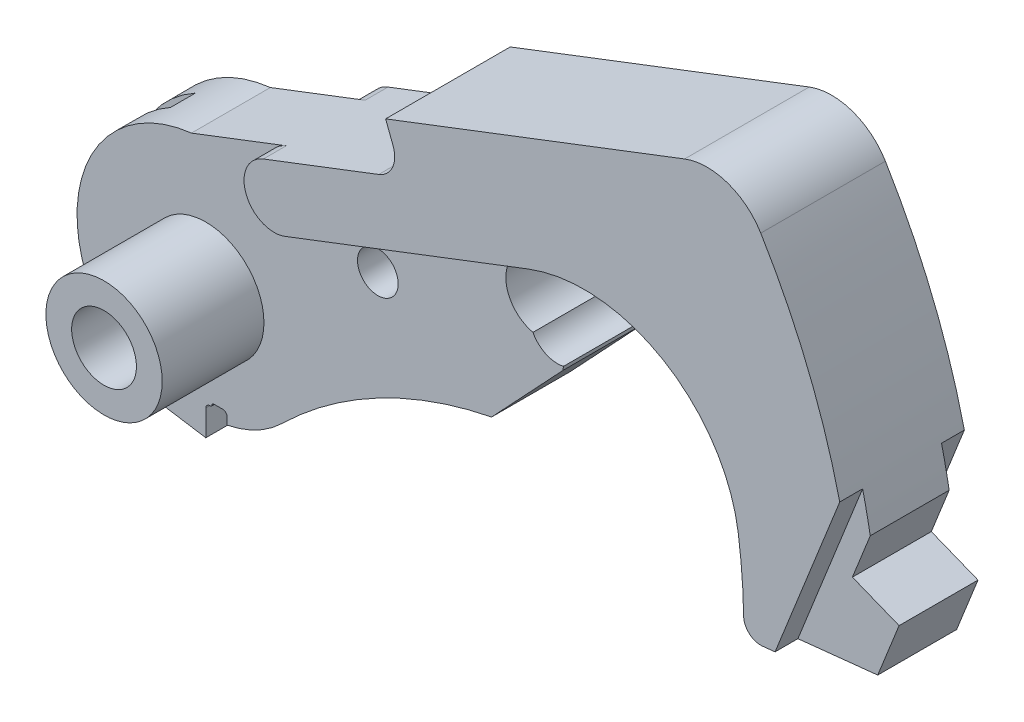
SolidWorks part; units mm, degrees
ref_plane "Front Plane" through (0, 0, 0) normal (0, 0, 1) x (1, 0, 0)
ref_plane "Top Plane" through (0, 0, 0) normal (0, 1, 0) x (1, 0, 0)
ref_plane "Right Plane" through (0, 0, 0) normal (1, 0, 0) x (0, 0, -1)
sketch "Sketch1" plane through (0, 0, 0) normal (0, 0, 1) x (1, 0, 0)
  circle A0 centre (0, 0) radius 1.9812
  circle A1 centre (0, 0) radius 3.556
  dimension "D1" = 3.9624
  dimension "D2" = 7.112
extrude "PinBoss" add sketch "Sketch1" along normal mid plane 17.272
sketch "Sketch2" plane through (0, 0, 0) normal (0, 0, 1) x (1, 0, 0)
  line L0 (0, -6.2994) -> (0, -7.874)
  line L1 (0, -7.874) -> (-2.4332, -7.4886)
  line L2 (0, -7.874) -> (-11.5163, -7.874) construction
  line L3 (0.254, -6.0454) -> (0.2794, -6.0454)
  line L4 (0.381, -5.9438) -> (0.381, -5.9436)
  line L5 (0.4826, -5.842) -> (1.0414, -5.842)
  line L6 (1.2954, -6.096) -> (1.2954, -6.5534)
  line L7 (0, 0) -> (17.4582, -45.4801) construction
  line L8 (0, 0) -> (0, -33.5309) construction
  line L9 (17.4765, 1.9642) -> (21.8252, 6.6015)
  line L10 (21.8252, 6.6015) -> (21.8765, 6.8503)
  line L11 (19.7173, 11.7859) -> (21.113, 12.3216)
  line L12 (15.6717, 16.3716) -> (21.2407, 1.8636) construction
  line L13 (20.0059, 7.7142) -> (17.916, -2.4134) construction
  line L14 (35.436, -0.4896) -> (41.0893, 0.1046)
  line L15 (0, 0) -> (50.1318, 19.2438) construction
  line L16 (41.0893, 0.1046) -> (42.3951, 3.3774)
  line L17 (42.3951, 3.3774) -> (39.5405, 4.5163)
  line L18 (39.5405, 4.5163) -> (40.6326, 7.2538)
  line L19 (12.3928, 15.912) -> (30.677, 22.9307)
  line L20 (11.9713, 12.7575) -> (-0.8787, 7.8248)
  line L21 (12.8479, 14.7264) -> (12.3928, 15.912)
  line L22 (10.5209, 6.1608) -> (11.6703, 6.6019) construction
  arc A0 (-0.8787, 7.8248) -> (-2.4332, -7.4886) centre (0, 0) ccw
  circle A1 centre (0, 0) radius 3.556 construction
  circle A2 centre (0, 0) radius 3.556
  arc A3 (1.2954, -6.5534) -> (4.6673, -4.7793) centre (0, 0) ccw
  arc A4 (17.4765, 1.9642) -> (4.6673, -4.7793) centre (22.4137, -22.9513) ccw
  arc A5 (0.381, -5.9436) -> (0.4826, -5.842) centre (0.4826, -5.9436) cw
  arc A6 (0.2794, -6.0454) -> (0.381, -5.9438) centre (0.2794, -5.9438) ccw
  arc A7 (1.0414, -5.842) -> (1.2954, -6.096) centre (1.0414, -6.096) cw
  arc A8 (0.254, -6.0454) -> (0, -6.2994) centre (0.254, -6.2994) ccw
  arc A9 (20.0059, 7.7142) -> (21.8765, 6.8503) centre (21.4957, 8.4829) ccw
  arc A10 (19.7173, 11.7859) -> (20.0059, 7.7142) centre (20.482, 9.794) ccw
  arc A11 (33.9597, 4.7482) -> (21.113, 12.3216) centre (24.5264, 3.4293) ccw
  arc A12 (34.2859, 0.53) -> (33.9597, 4.7482) centre (0, 0) ccw
  arc A13 (40.6326, 7.2538) -> (35.3349, 21.3323) centre (0, 0) ccw
  arc A14 (35.3349, 21.3323) -> (30.677, 22.9307) centre (32.0515, 19.3501) ccw
  arc A15 (11.9713, 12.7575) -> (12.8479, 14.7264) centre (11.4251, 14.1802) ccw
  arc A16 (35.436, -0.4896) -> (34.2859, 0.53) centre (35.3272, 0.5461) cw
  circle A17 centre (10.5209, 6.1608) radius 1.2446
  point P24 (0.381, -6.0454)
  point P29 (0, -6.0454)
  point P37 (20.0059, 7.7142)
  dimension "D2" = 7.874
  dimension "D3" = 13.3604
  dimension "D4" = 50.8
  dimension "D5" = 32.0802
  dimension "D6" = 21
  dimension "D9" = 11.4046
  dimension "D12" = 5.842
  dimension "D16" = 0.1016
  dimension "D17" = 0.254
  dimension "D18" = 3.3528
  dimension "D21" = 3.937
  dimension "D22" = 4.2672
  dimension "D24" = 19.05
  dimension "D26" = 68.58
  dimension "D28" = 21
  dimension "D29" = 4.191
  dimension "D30" = 82.55
  dimension "D32" = 18.8468
  dimension "D33" = 38.1254
  dimension "D35" = 10.414
  dimension "D36" = 7.62
  dimension "D38" = 3.8354
  dimension "D39" = 1.524
  dimension "D40" = 1.0414
  dimension "D42" = 12.192
  dimension "D43" = 2.4892
  dimension "D1" = 9
  dimension "D7" = 12.7
  dimension "D8" = 43.16
  dimension "D10" = 11.66
  dimension "D11" = 20.0406
  dimension "D13" = 0.508
  dimension "D14" = 0.381
  dimension "D15" = 1.2954
  dimension "D19" = 0.254
  dimension "D20" = 21
  dimension "D23" = 20.4978
  dimension "D25" = 18.034
  dimension "D27" = 15
  dimension "D31" = 21.75
  dimension "D34" = 35.052
  dimension "D37" = 17.272
  dimension "D41" = 1.9812
extrude "SearBoss" add sketch "Sketch2" along normal mid plane 4.826
sketch "Sketch3" plane through (0, 0, 0) normal (0, 0, 1) x (1, 0, 0)
  line L0 (30.677, 22.9307) -> (12.3928, 15.912) construction
  line L1 (30.677, 22.9307) -> (12.3928, 15.912)
  line L2 (35.436, -0.4896) -> (41.0893, 0.1046) construction
  line L3 (35.436, -0.4896) -> (36.2083, -0.4084)
  line L4 (19.7173, 11.7859) -> (21.113, 12.3216) construction
  line L5 (6.2365, 6.6111) -> (21.113, 12.3216)
  line L6 (1.3979, 14.0776) -> (9.5766, -7.2286) construction
  line L7 (11.9713, 12.7575) -> (-0.8787, 7.8248) construction
  line L8 (11.9713, 12.7575) -> (4.9167, 10.0495)
  line L9 (12.3928, 15.912) -> (12.8479, 14.7264) construction
  line L10 (12.3928, 15.912) -> (12.8479, 14.7264)
  line L11 (40.1648, 9.5086) -> (36.2083, -0.4084)
  line L12 (41.0893, 0.1046) -> (42.3951, 3.3774) construction
  arc A0 (35.3349, 21.3323) -> (30.677, 22.9307) centre (32.0515, 19.3501) ccw construction
  arc A1 (35.3349, 21.3323) -> (30.677, 22.9307) centre (32.0515, 19.3501) ccw
  arc A2 (40.6326, 7.2538) -> (35.3349, 21.3323) centre (0, 0) ccw construction
  arc A3 (40.1648, 9.5086) -> (35.3349, 21.3323) centre (0, 0) ccw
  arc A4 (34.2859, 0.53) -> (35.436, -0.4896) centre (35.3272, 0.5461) ccw construction
  arc A5 (34.2859, 0.53) -> (35.436, -0.4896) centre (35.3272, 0.5461) ccw
  arc A6 (34.2859, 0.53) -> (33.9597, 4.7482) centre (0, 0) ccw construction
  arc A7 (34.2859, 0.53) -> (33.9597, 4.7482) centre (0, 0) ccw
  arc A8 (33.9597, 4.7482) -> (21.113, 12.3216) centre (24.5264, 3.4293) ccw construction
  arc A9 (33.9597, 4.7482) -> (21.113, 12.3216) centre (24.5264, 3.4293) ccw
  circle A10 centre (0, 0) radius 3.556 construction
  arc A11 (4.9167, 10.0495) -> (6.2365, 6.6111) centre (5.5766, 8.3303) ccw
  arc A12 (11.9713, 12.7575) -> (12.8479, 14.7264) centre (11.4251, 14.1802) ccw construction
  arc A13 (11.9713, 12.7575) -> (12.8479, 14.7264) centre (11.4251, 14.1802) ccw
  circle A14 centre (0, 0) radius 3.556 construction
  dimension "D1" = 6.35
  dimension "D2" = 33.782
extrude "StrikefaceBoss" add sketch "Sketch3" along normal mid plane 7.62
sketch "Sketch4" plane through (0, 0, 0) normal (0, 0, 1) x (1, 0, 0)
  line L0 (-3.81, 6.8908) -> (-3.81, -6.8908)
  circle A0 centre (0, 0) radius 3.556 construction
  arc A1 (-0.8787, 7.8248) -> (-2.4332, -7.4886) centre (0, 0) ccw construction
  arc A2 (-3.81, 6.8908) -> (-3.81, -6.8908) centre (0, 0) ccw
  dimension "D1" = 3.81
extrude "SlotCut" cut sketch "Sketch4" against normal mid plane 1.524
sketch "Sketch5" plane through (0, 0, 0) normal (0, 0, 1) x (1, 0, 0)
  line L0 (0, 0) -> (23.4653, 9.0075) construction
  line L1 (-12.5665, -2.7017) -> (14.5094, 7.6918) construction
  line L2 (19.7173, 11.7859) -> (6.2365, 6.6111) construction
  line L3 (-13.0944, -1.3263) -> (4.6903, 5.5006)
  line L4 (4.6903, 5.5006) -> (5.5076, 4.8621)
  line L5 (5.5076, 4.8621) -> (13.9724, 8.1114)
  line L6 (13.9724, 8.1114) -> (14.5094, 7.6918)
  line L7 (5.5076, 4.8621) -> (3.5985, 9.8354) construction
  line L8 (4.6903, 5.5006) -> (0.0687, 17.5402) construction
  line L9 (13.9724, 8.1114) -> (9.108, 20.7836) construction
  line L10 (-13.0944, -1.3263) -> (-12.5665, -2.7017)
  line L11 (-12.5665, -2.7017) -> (14.5094, 7.6918)
  circle A2 centre (0, 0) radius 3.556 construction
  circle A3 centre (0, 0) radius 3.556 construction
  point P4 (10.5209, 6.1608)
  dimension "D6" = 12.7
  dimension "D1" = 31
  dimension "D2" = 2.9464
  dimension "D3" = 1.1684
  dimension "D4" = 6.35
  dimension "D5" = 15.9512
revolve "HoleThruSlotCut" cut sketch "Sketch5" angle 360 about L11
